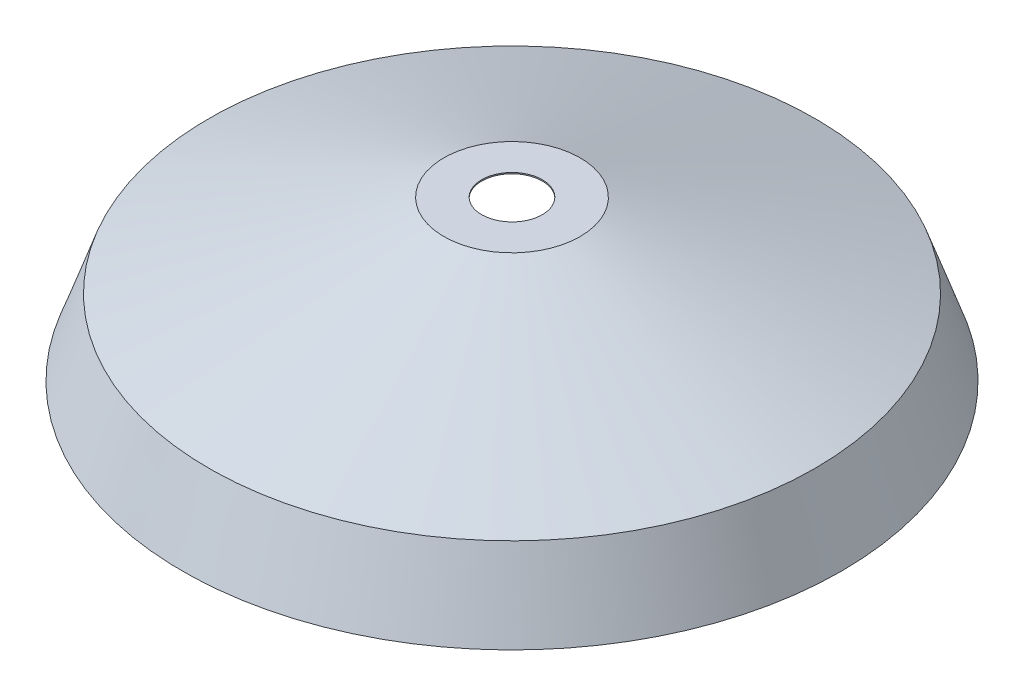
SolidWorks part; units mm, degrees
ref_plane "Alzado" through (0, 0, 0) normal (0, 0, 1) x (1, 0, 0)
ref_plane "Planta" through (0, 0, 0) normal (0, 1, 0) x (1, 0, 0)
ref_plane "Vista lateral" through (0, 0, 0) normal (1, 0, 0) x (0, 0, -1)
sketch "Croquis1" plane through (0, 0, 0) normal (0, 0, 1) x (1, 0, 0)
  line L1 (217.5, -52.5) -> (200, -2.5)
  line L2 (216.6524, -52.5) -> (199.3715, -3.1258)
  line L3 (200, -2.5) -> (45, 52.5)
  line L4 (199.3715, -3.1258) -> (44.8623, 51.7)
  line L5 (0, 52.5) -> (0, 51.7)
  line L9 (20, 51.7) -> (20, 52.5)
  line L12 (20, 51.7) -> (20, 52.5)
  line L14 (0, 52.5) -> (45, 52.5)
  line L15 (44.8623, 51.7) -> (0, 51.7)
  line L16 (0, 142.443) -> (0, -247.443) construction
  line L17 (216.6524, -52.5) -> (217.5, -52.5)
  line L18 (197.6077, -2.5) -> (200, -2.5)
  point P20 (0, -52.5)
revolve "Revolución1" add sketch "Croquis1" angle 360 about L16
sketch "Croquis2" plane through (0, 52.5, 0) normal (0, 1, 0) x (1, 0, 0)
  circle A0 centre (0, 0) radius 20
  dimension "D1" = 40
extrude "Cortar-Extruir1" cut sketch "Croquis2" against normal blind 10 contours A0
